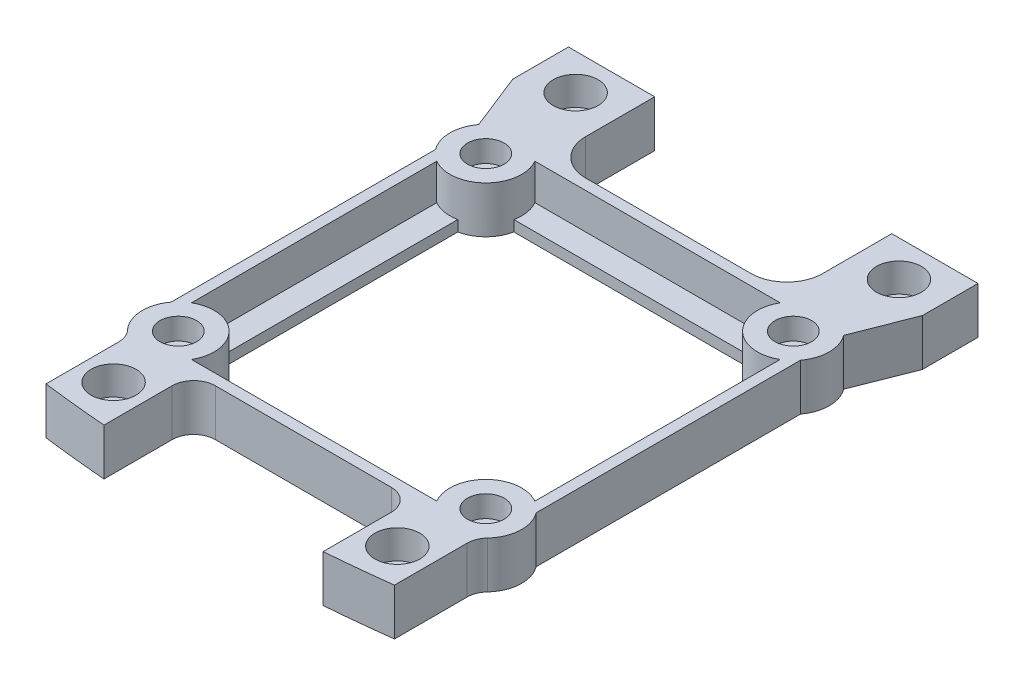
SolidWorks part; units mm, degrees
ref_plane "Front Plane" through (0, 0, 0) normal (0, 0, 1) x (1, 0, 0)
ref_plane "Top Plane" through (0, 0, 0) normal (0, 1, 0) x (1, 0, 0)
ref_plane "Right Plane" through (0, 0, 0) normal (1, 0, 0) x (0, 0, -1)
sketch "Sketch1" plane through (0, 0, 0) normal (0, 1, 0) x (1, 0, 0)
  line L0 (20.4, 20.4) -> (-20.4, 20.4)
  line L1 (21.4, -21.4) -> (-21.4, -21.4) construction
  line L2 (21.4, -21.4) -> (21.4, 21.4) construction
  line L3 (21.4, 21.4) -> (-21.4, 21.4) construction
  line L4 (-21.4, -21.4) -> (-21.4, 21.4) construction
  line L5 (21.4, -21.4) -> (-21.4, 21.4) construction
  line L6 (21.4, 21.4) -> (-21.4, -21.4) construction
  line L7 (-20.4, -20.4) -> (-20.4, 20.4)
  line L8 (20.4, -20.4) -> (-20.4, -20.4)
  line L9 (20.4, -20.4) -> (20.4, 20.4)
  line L10 (25.4, 25.4) -> (-25.4, 25.4)
  line L11 (-25.4, -25.4) -> (-25.4, 25.4)
  line L12 (25.4, -25.4) -> (-25.4, -25.4)
  line L13 (25.4, -25.4) -> (25.4, 25.4)
  circle A0 centre (-21.4, 21.4) radius 1.375
  circle A1 centre (21.4, 21.4) radius 1.375
  circle A2 centre (21.4, -21.4) radius 1.375
  circle A3 centre (-21.4, -21.4) radius 1.375
  point P0 (0, 0)
  dimension "D2" = 2.75
  dimension "D1" = 42.8
  dimension "D3" = 1
  dimension "D4" = 4
extrude "Boss-Extrude1" add sketch "Sketch1" along normal blind 1.5
sketch "Sketch2" plane through (0, 1.5, 0) normal (0, 1, 0) x (1, 0, 0)
  line L0 (23.9, 23.9) -> (-23.9, 23.9)
  line L1 (-23.9, 23.9) -> (-23.9, -23.9)
  line L2 (-23.9, -23.9) -> (23.9, -23.9)
  line L3 (23.9, -23.9) -> (23.9, 23.9)
  line L4 (25.4, -25.4) -> (25.4, 25.4)
  line L5 (25.4, 25.4) -> (-25.4, 25.4)
  line L6 (-25.4, 25.4) -> (-25.4, -25.4)
  line L7 (-25.4, -25.4) -> (25.4, -25.4)
  line L8 (25.4, -25.4) -> (25.4, 25.4)
  line L9 (25.4, 25.4) -> (-25.4, 25.4)
  line L10 (-25.4, 25.4) -> (-25.4, -25.4)
  line L11 (-25.4, -25.4) -> (25.4, -25.4)
  dimension "D1" = 0
  dimension "D2" = 1.5
extrude "Boss-Extrude2" add sketch "Sketch2" along normal blind 5
fillet "Fillet2" radius 3 8 edges at (23.9, 4, -23.9) (25.4, 3.25, -25.4) (23.9, 4, 23.9) (25.4, 3.25, 25.4) (-23.9, 4, 23.9) (-25.4, 3.25, 25.4) (-25.4, 3.25, -25.4) (-23.9, 4, -23.9)
sketch "Sketch5" plane through (0, 6.5, 0) normal (0, 1, 0) x (1, 0, 0)
  circle A0 centre (-21.4, 21.4) radius 5
  circle A1 centre (21.4, 21.4) radius 5
  circle A2 centre (21.4, -21.4) radius 5
  circle A3 centre (-21.4, -21.4) radius 5
  circle A4 centre (21.4, -21.4) radius 1.375 construction
  circle A5 centre (-21.4, -21.4) radius 1.375 construction
  circle A6 centre (21.4, 21.4) radius 1.375 construction
  circle A7 centre (-21.4, 21.4) radius 1.375 construction
  circle A8 centre (21.4, -21.4) radius 1.375
  circle A9 centre (-21.4, -21.4) radius 1.375
  circle A10 centre (21.4, 21.4) radius 1.375
  circle A11 centre (-21.4, 21.4) radius 1.375
  dimension "D1" = 10
extrude "Boss-Extrude3" add sketch "Sketch5" against normal up to surface (6.5 mm away)
sketch "Sketch6" plane through (0, 6.5, 0) normal (0, 1, 0) x (1, 0, 0)
  circle A0 centre (-21.4, 21.4) radius 2.55
  circle A1 centre (21.4, 21.4) radius 2.55
  circle A2 centre (-21.4, -21.4) radius 2.55
  circle A3 centre (21.4, -21.4) radius 2.55
  dimension "D1" = 5.1
extrude "Cut-Extrude1" cut sketch "Sketch6" against normal blind 3
sketch "Sketch7" plane through (0, 6.5, 0) normal (0, 1, 0) x (1, 0, 0)
  line L0 (16.5, 25.4) -> (16.5, 40)
  line L1 (18.4, 25.4) -> (-18.4, 25.4) construction
  line L2 (16.5, 40) -> (28.5, 40)
  line L5 (18.4, 25.4) -> (16.5, 25.4)
  line L7 (28.5, 40) -> (28.5, 32.25)
  line L8 (28.5, 32.25) -> (25.4, 24.4)
  line L9 (25.4, -18.4) -> (25.4, 18.4) construction
  arc A0 (25.4, 18.4) -> (18.4, 25.4) centre (21.4, 21.4) ccw construction
  arc A1 (25.4, 24.4) -> (18.4, 25.4) centre (21.4, 21.4) ccw
  circle A2 centre (22.5, 35) radius 1.55
  point P7 (22.5, 40)
  dimension "D5" = 5
  dimension "D6" = 3.1
  dimension "D1" = 40
  dimension "D2" = 16.5
  dimension "D3" = 12
  dimension "D4" = 7.75
extrude "Boss-Extrude4" add sketch "Sketch7" against normal up to surface (6.5 mm away)
sketch "Sketch8" plane through (0, 6.5, 0) normal (0, 1, 0) x (1, 0, 0)
  circle A0 centre (22.5, 35) radius 3.125
  dimension "D1" = 6.25
extrude "Cut-Extrude2" cut sketch "Sketch8" against normal blind 4
mirror "Mirror1" about plane through (0, 0, 0) normal (1, 0, 0) of "Cut-Extrude2", "Boss-Extrude4"
fillet "Fillet3" radius 5 2 edges at (16.5, 3.25, -25.4) (-16.5, 3.25, -25.4)
sketch "Sketch9" plane through (0, 6.5, 0) normal (0, 1, 0) x (1, 0, 0)
  line L0 (-24.25, -25.5082) -> (-24.25, -36.9624)
  line L1 (-15.25, -25.4) -> (-15.25, -37.8934)
  line L2 (-18.4, -25.4) -> (18.4, -25.4) construction
  line L3 (-18.4, -25.4) -> (-15.25, -25.4)
  arc A0 (-25.4, -18.4) -> (-18.4, -25.4) centre (-21.4, -21.4) ccw construction
  arc A3 (-24.25, -25.5082) -> (-18.4, -25.4) centre (-21.4, -21.4) ccw
  arc A5 (-24.25, -36.9624) -> (-15.25, -37.8934) centre (0, 153.5) ccw
  arc A7 (-76.8129, -22.4653) -> (-4.75, -38.4412) centre (0, 153.5) ccw construction
  dimension "D1" = 9
  dimension "D2" = 15.25
extrude "Boss-Extrude5" add sketch "Sketch9" against normal up to surface (6.5 mm away)
sketch "Sketch10" plane through (0, 6.5, 0) normal (0, 1, 0) x (1, 0, 0)
  line L0 (-24.25, -32.06) -> (-15.25, -32.06) construction
  line L1 (-24.25, -25.5082) -> (-24.25, -36.9624) construction
  line L2 (-15.25, -37.8934) -> (-15.25, -25.4) construction
  line L3 (-15.25, -25.4) -> (18.4, -25.4) construction
  circle A0 centre (-19.75, -32.06) radius 3.125
  circle A2 centre (22.5, 35) radius 3.125 construction
  point P9 (-19.75, -32.06)
  dimension "D1" = 6.66
extrude "Cut-Extrude3" cut sketch "Sketch10" against normal blind 4
sketch "Sketch11" plane through (0, 2.5, 0) normal (0, 1, 0) x (1, 0, 0)
  circle A0 centre (-19.75, -32.06) radius 1.55
  dimension "D1" = 3.1
extrude "Cut-Extrude4" cut sketch "Sketch11" against normal through all
mirror "Mirror2" about plane through (0, 0, 0) normal (1, 0, 0) of "Cut-Extrude4", "Cut-Extrude3", "Boss-Extrude5"
fillet "Fillet4" radius 3 4 edges at (-24.25, 3.25, 25.5082) (24.25, 3.25, 25.5082) (15.25, 3.25, 25.4) (-15.25, 3.25, 25.4)
